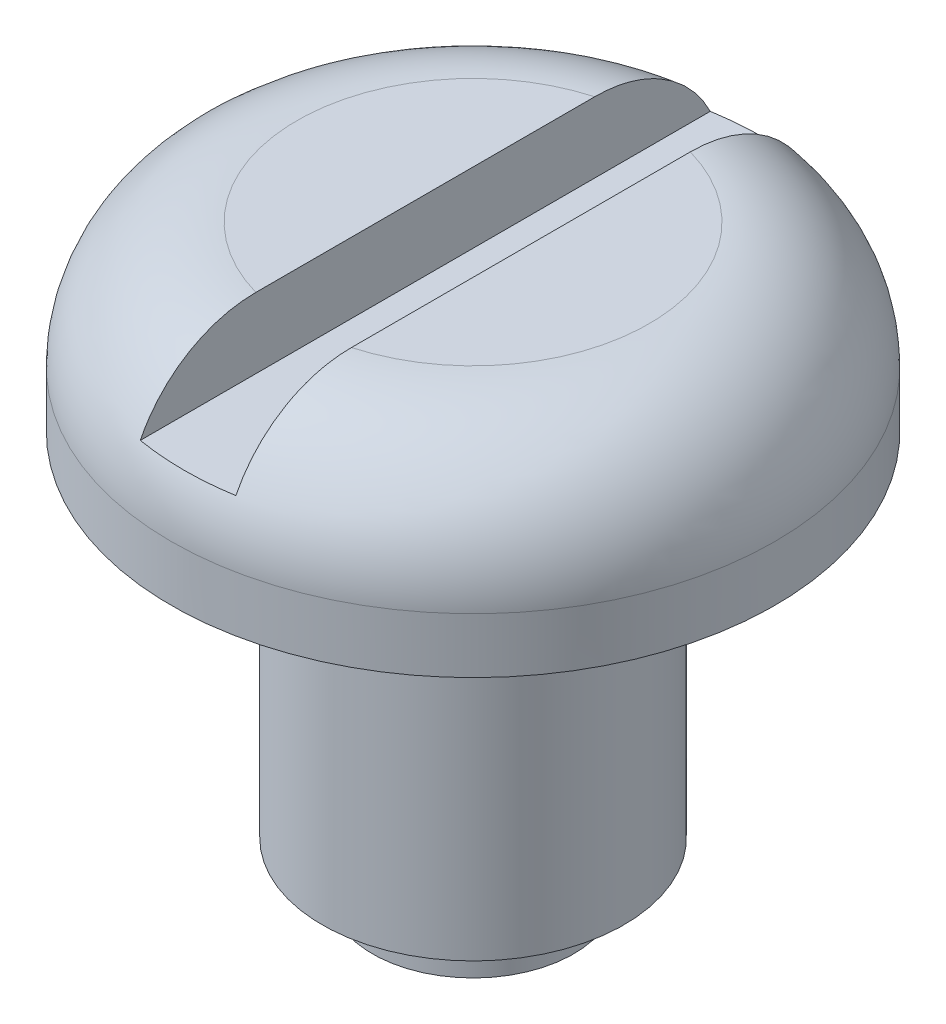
SolidWorks part; units mm, degrees
ref_plane "Front Plane" through (0, 0, 0) normal (0, 0, 1) x (1, 0, 0)
ref_plane "Top Plane" through (0, 0, 0) normal (0, 1, 0) x (1, 0, 0)
ref_plane "Right Plane" through (0, 0, 0) normal (1, 0, 0) x (0, 0, -1)
sketch "Sketch1" plane through (0, 0, 0) normal (0, 0, 1) x (1, 0, 0)
  line L0 (0, 0) -> (2, 0)
  line L1 (2, 0) -> (2, 1)
  line L2 (2, 1) -> (3, 1)
  line L3 (3, 1) -> (3, 8)
  line L4 (3, 8) -> (6, 8)
  line L5 (6, 8) -> (6, 11.6)
  line L6 (0, 11.6) -> (0, 0)
  line L7 (0, 0) -> (0, 17.46) construction
  line L8 (0, 11.6) -> (6, 11.6)
  dimension "D7" = 3.6
  dimension "D1" = 4
  dimension "D2" = 6
  dimension "D3" = 12
  dimension "D4" = 1
  dimension "D5" = 7
revolve "Revolve1" add sketch "Sketch1" angle 360 about L7
fillet "Fillet1" radius 2.5 1 edges at (0, 11.6, -6)
sketch "Sketch2" plane through (0, 11.6, 0) normal (0, 1, 0) x (1, 0, 0)
  line L1 (-0.95, -6.7154) -> (0.95, -6.7154)
  line L2 (-0.95, -6.7154) -> (-0.95, 6.7154)
  line L3 (-0.95, 6.7154) -> (0.95, 6.7154)
  line L4 (0.95, -6.7154) -> (0.95, 6.7154)
  line L5 (-0.95, -6.7154) -> (0.95, 6.7154) construction
  line L6 (-0.95, 6.7154) -> (0.95, -6.7154) construction
  point P0 (0, 0)
  dimension "D1" = 1.9
extrude "Cut-Extrude1" cut sketch "Sketch2" against normal blind 1.4
